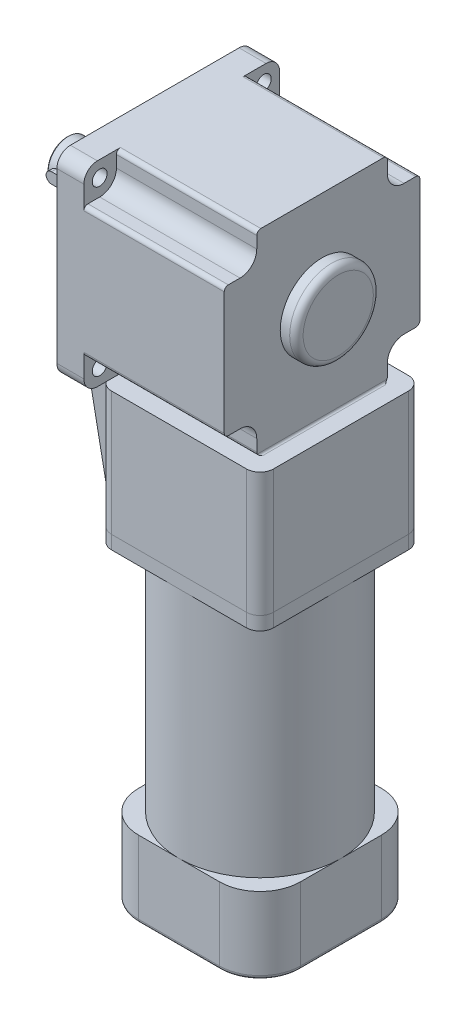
SolidWorks part; units mm, degrees
ref_plane "前视基准面" through (0, 0, 0) normal (0, 0, 1) x (1, 0, 0)
ref_plane "上视基准面" through (0, 0, 0) normal (0, 1, 0) x (1, 0, 0)
ref_plane "右视基准面" through (0, 0, 0) normal (1, 0, 0) x (0, 0, -1)
sketch "草图1" plane through (0, 0, 0) normal (1, 0, 0) x (0, 0, -1)
  line L1 (-62.5, -72.5) -> (62.5, -72.5)
  line L2 (-72.5, -62.5) -> (-72.5, 62.5)
  line L3 (-62.5, 72.5) -> (62.5, 72.5)
  line L4 (72.5, -62.5) -> (72.5, 62.5)
  line L5 (-72.5, -72.5) -> (72.5, 72.5) construction
  line L6 (-72.5, 72.5) -> (72.5, -72.5) construction
  arc A0 (62.5, 72.5) -> (72.5, 62.5) centre (62.5, 62.5) cw
  arc A1 (62.5, -72.5) -> (72.5, -62.5) centre (62.5, -62.5) ccw
  arc A2 (-62.5, -72.5) -> (-72.5, -62.5) centre (-62.5, -62.5) cw
  arc A3 (-72.5, 62.5) -> (-62.5, 72.5) centre (-62.5, 62.5) cw
  point P0 (0, 0)
  dimension "D1" = 10
extrude "凸台-拉伸1" add sketch "草图1" along normal blind 124
sketch "草图2" plane through (124, 0, 0) normal (1, 0, 0) x (0, 0, -1)
  line L0 (-60.8, 48.3958) -> (-69.5, 48.3958)
  line L1 (-72.5, -62.5) -> (-72.5, -45.3958)
  line L3 (-62.5, 72.5) -> (-45.3958, 72.5)
  line L5 (72.5, 62.5) -> (72.5, 45.3958)
  line L6 (-45.3958, -72.5) -> (-62.5, -72.5)
  line L7 (-72.5, 62.5) -> (-72.5, -62.5) construction
  line L8 (45.3958, 72.5) -> (62.5, 72.5)
  line L9 (-69.5, -48.3958) -> (-60.8, -48.3958)
  line L10 (62.5, -72.5) -> (45.3958, -72.5)
  line L11 (-48.3958, -60.8) -> (-48.3958, -69.5)
  line L12 (-62.5, -72.5) -> (62.5, -72.5) construction
  line L13 (72.5, -45.3958) -> (72.5, -62.5)
  line L14 (48.3958, -69.5) -> (48.3958, -60.8)
  line L15 (-72.5, 45.3958) -> (-72.5, 62.5)
  line L16 (60.8, -48.3958) -> (69.5, -48.3958)
  line L17 (72.5, -62.5) -> (72.5, 62.5) construction
  line L19 (69.5, 48.3958) -> (60.8, 48.3958)
  line L21 (48.3958, 60.8) -> (48.3958, 69.5)
  line L22 (62.5, 72.5) -> (-62.5, 72.5) construction
  line L24 (-48.3958, 69.5) -> (-48.3958, 60.8)
  arc A0 (-60.8, 48.3958) -> (-48.3958, 60.8) centre (-60.8, 60.8) ccw
  arc A1 (48.3958, 60.8) -> (60.8, 48.3958) centre (60.8, 60.8) ccw
  arc A2 (60.8, -48.3958) -> (48.3958, -60.8) centre (60.8, -60.8) ccw
  arc A3 (-48.3958, -60.8) -> (-60.8, -48.3958) centre (-60.8, -60.8) ccw
  arc A4 (-45.3958, 72.5) -> (-48.3958, 69.5) centre (-45.3958, 69.5) ccw
  arc A5 (48.3958, 69.5) -> (45.3958, 72.5) centre (45.3958, 69.5) ccw
  arc A6 (72.5, 45.3958) -> (69.5, 48.3958) centre (69.5, 45.3958) ccw
  arc A7 (69.5, -48.3958) -> (72.5, -45.3958) centre (69.5, -45.3958) ccw
  arc A8 (45.3958, -72.5) -> (48.3958, -69.5) centre (45.3958, -69.5) ccw
  arc A9 (-48.3958, -69.5) -> (-45.3958, -72.5) centre (-45.3958, -69.5) ccw
  arc A10 (-72.5, -45.3958) -> (-69.5, -48.3958) centre (-69.5, -45.3958) ccw
  arc A11 (-69.5, 48.3958) -> (-72.5, 45.3958) centre (-69.5, 45.3958) ccw
  arc A12 (-62.5, 72.5) -> (-72.5, 62.5) centre (-62.5, 62.5) ccw
  arc A13 (72.5, 62.5) -> (62.5, 72.5) centre (62.5, 62.5) ccw
  arc A14 (-72.5, -62.5) -> (-62.5, -72.5) centre (-62.5, -62.5) ccw
  arc A15 (62.5, -72.5) -> (72.5, -62.5) centre (62.5, -62.5) ccw
  point P0 (0, 0)
  point P8 (-48.3958, 72.5)
  point P35 (48.3958, 72.5)
  point P38 (72.5, 48.3958)
  point P41 (72.5, -48.3958)
  point P44 (48.3958, -72.5)
  point P47 (-48.3958, -72.5)
  point P50 (-72.5, -48.3958)
  point P53 (-72.5, 48.3958)
  dimension "D1" = 3
extrude "切除-拉伸1" cut sketch "草图2" against normal blind 104
sketch "草图3" plane through (0, 0, 0) normal (-1, 0, 0) x (0, 0, 1)
  circle A0 centre (-60.8, 60.8) radius 5.5
  circle A1 centre (60.8, 60.8) radius 5.5
  circle A2 centre (60.8, -60.8) radius 5.5
  circle A3 centre (-60.8, -60.8) radius 5.5
  point P0 (0, 0)
extrude "切除-拉伸2" cut sketch "草图3" against normal blind 20
sketch "草图4" plane through (0, 0, 0) normal (-1, 0, 0) x (0, 0, 1)
  line L9 (-47.2986, 61.204) -> (-66.9163, 3.204)
  line L10 (-37.8258, 68) -> (37.8258, 68)
  line L11 (47.2986, 61.204) -> (66.9163, 3.204)
  line L13 (-47.2986, -61.204) -> (-66.9163, -3.204)
  line L14 (-37.8258, -68) -> (37.8258, -68)
  line L15 (47.2986, -61.204) -> (66.9163, -3.204)
  arc A0 (37.8258, 68) -> (47.2986, 61.204) centre (37.8258, 58) cw
  arc A1 (66.9163, -3.204) -> (66.9163, 3.204) centre (57.4435, 0) ccw
  arc A2 (37.8258, -68) -> (47.2986, -61.204) centre (37.8258, -58) ccw
  arc A3 (-47.2986, -61.204) -> (-37.8258, -68) centre (-37.8258, -58) ccw
  arc A4 (-66.9163, -3.204) -> (-66.9163, 3.204) centre (-57.4435, 0) cw
  arc A5 (-37.8258, 68) -> (-47.2986, 61.204) centre (-37.8258, 58) ccw
  dimension "D1" = 10
extrude "切除-拉伸3" cut sketch "草图4" against normal blind 1
fillet "圆角2" radius 1 12 edges at (1, 66.1253, -43.655) (1, 68, 0) (1, 66.1253, 43.655) (1, 32.204, 57.1075) (1, 0, 67.4435) (1, -32.204, 57.1075) (1, -66.1253, 43.655) (1, -68, 0) (1, -66.1253, -43.655) (1, -32.204, -57.1075) (1, 0, -67.4435) (1, 32.204, -57.1075)
sketch "草图5" plane through (1, 0, 0) normal (-1, 0, 0) x (0, 0, 1)
  circle A0 centre (0, 0) radius 27.5
extrude "凸台-拉伸2" add sketch "草图5" along normal blind 4
sketch "草图6" plane through (-3, 0, 0) normal (-1, 0, 0) x (0, 0, 1)
  circle A0 centre (0, 0) radius 22.5
extrude "凸台-拉伸3" add sketch "草图6" along normal blind 12 separate body
fillet "圆角3" radius 1 1 edges at (-3, 0, 27.5)
fillet "圆角4" radius 1.5 1 edges at (-15, 0, 22.5)
sketch "草图7" plane through (-15, 0, 0) normal (-1, 0, 0) x (0, 0, 1)
  circle A0 centre (0, 0) radius 15
extrude "凸台-拉伸4" add sketch "草图7" along normal blind 1.5
fillet "圆角5" radius 1.5 1 edges at (-15, 0, 15)
sketch "草图8" plane through (-16.5, 0, 0) normal (-1, 0, 0) x (0, 0, 1)
  circle A0 centre (0, 0) radius 15
extrude "凸台-拉伸5" add sketch "草图8" along normal blind 48.5
ref_plane "基准面1" through (0, 0, 15) normal (0, 0, 1) x (1, 0, 0)
sketch "草图9" plane through (0, 0, 15) normal (0, 0, 1) x (1, 0, 0)
  line L3 (-58.5, 4) -> (-21.5, 4)
  line L5 (-21.5, -4) -> (-58.5, -4)
  arc A0 (-58.5, 4) -> (-58.5, -4) centre (-58.5, 0) ccw
  arc A1 (-21.5, -4) -> (-21.5, 4) centre (-21.5, 0) ccw
extrude "切除-拉伸4" cut sketch "草图9" against normal blind 5
sketch "草图10" plane through (0, 0, 10) normal (0, 0, 1) x (1, 0, 0)
  line L0 (-58.5, 4) -> (-21.5, 4)
  line L2 (-21.5, -4) -> (-58.5, -4)
  arc A0 (-58.5, 4) -> (-58.5, -4) centre (-58.5, 0) ccw
  arc A1 (-21.5, -4) -> (-21.5, 4) centre (-21.5, 0) ccw
extrude "凸台-拉伸6" add sketch "草图10" along normal blind 8 separate body
chamfer "倒角1" distance 1 angle 45 1 edges at (-65, 0, 15)
sketch "草图11" plane through (0, -72.5, 0) normal (0, -1, 0) x (1, 0, 0)
  line L3 (28, -60) -> (128, -60)
  line L4 (18, -50) -> (18, 50)
  line L5 (28, 60) -> (128, 60)
  line L6 (138, -50) -> (138, 50)
  line L7 (18, -60) -> (138, 60) construction
  line L8 (18, 60) -> (138, -60) construction
  arc A0 (28, -60) -> (18, -50) centre (28, -50) cw
  arc A1 (128, -60) -> (138, -50) centre (128, -50) ccw
  arc A2 (128, 60) -> (138, 50) centre (128, 50) cw
  arc A3 (18, 50) -> (28, 60) centre (28, 50) cw
  point P3 (78, 0)
  dimension "D1" = 10
extrude "凸台-拉伸7" add sketch "草图11" along normal blind 92
fillet "圆角8" radius 1.5 1 edges at (124, -72.5, 0)
ref_plane "基准面2" through (0, 0, 50) normal (0, 0, 1) x (1, 0, 0)
ref_plane "基准面3" through (0, 0, -50) normal (0, 0, 1) x (1, 0, 0)
sketch "草图12" plane through (0, 0, 50) normal (0, 0, 1) x (1, 0, 0)
  line L0 (18, -72.5) -> (0, -72.5)
  line L1 (0, -72.5) -> (18, -164.5)
  line L2 (18, -164.5) -> (18, -72.5)
extrude "凸台-拉伸8" add sketch "草图12" against normal blind 15
sketch "草图14" plane through (0, 0, -50) normal (0, 0, 1) x (1, 0, 0)
  line L0 (18, -72.5) -> (0, -72.5)
  line L1 (0, -72.5) -> (18, -164.5)
  line L2 (18, -164.5) -> (18, -72.5)
extrude "凸台-拉伸9" add sketch "草图14" along normal blind 15
sketch "草图15" plane through (0, -164.5, 0) normal (0, -1, 0) x (1, 0, 0)
  line L4 (28, -60) -> (128, -60)
  line L5 (18, -50) -> (18, 50)
  line L6 (28, 60) -> (128, 60)
  line L7 (138, -50) -> (138, 50)
  line L8 (18, -60) -> (138, 60) construction
  line L9 (18, 60) -> (138, -60) construction
  arc A0 (128, -60) -> (138, -50) centre (128, -50) ccw
  arc A1 (28, -60) -> (18, -50) centre (28, -50) cw
  arc A2 (18, 50) -> (28, 60) centre (28, 50) cw
  arc A3 (128, 60) -> (138, 50) centre (128, 50) cw
  point P6 (78, 0)
  dimension "D1" = 10
extrude "凸台-拉伸10" add sketch "草图15" along normal blind 10 separate body
sketch "草图16" plane through (0, -174.5, 0) normal (0, -1, 0) x (1, 0, 0)
  circle A0 centre (78, 0) radius 60
extrude "凸台-拉伸11" add sketch "草图16" along normal blind 173 separate body
sketch "草图17" plane through (0, -347.5, 0) normal (0, -1, 0) x (1, 0, 0)
  line L1 (48, -60) -> (108, -60)
  line L2 (18, -30) -> (18, 30)
  line L3 (48, 60) -> (108, 60)
  line L4 (138, -30) -> (138, 30)
  line L5 (18, -60) -> (138, 60) construction
  line L6 (18, 60) -> (138, -60) construction
  arc A0 (108, 60) -> (138, 30) centre (108, 30) cw
  arc A1 (18, 30) -> (48, 60) centre (48, 30) cw
  arc A2 (108, -60) -> (138, -30) centre (108, -30) ccw
  arc A3 (48, -60) -> (18, -30) centre (48, -30) cw
  point P0 (78, 0)
  dimension "D1" = 30
  dimension "D2" = 30
extrude "凸台-拉伸13" add sketch "草图17" along normal blind 57
fillet "圆角9" radius 3 8 edges at (138, -404.5, 0) (129.2132, -404.5, -51.2132) (78, -404.5, -60) (26.7868, -404.5, -51.2132) (18, -404.5, 0) (26.7868, -404.5, 51.2132) (78, -404.5, 60) (129.2132, -404.5, 51.2132)
sketch "草图19" plane through (124, 0, 0) normal (1, 0, 0) x (0, 0, -1)
  circle A0 centre (0, 0) radius 31
extrude "凸台-拉伸14" add sketch "草图19" along normal blind 12
fillet "圆角10" radius 5 1 edges at (136, 0, -31)
